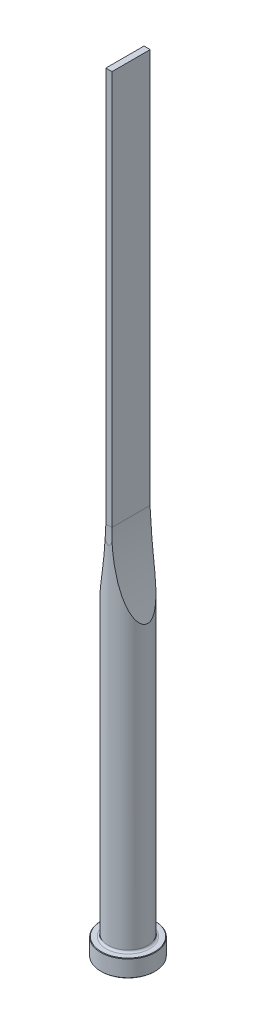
SolidWorks part; units mm, degrees
ref_plane "Front Plane" through (0, 0, 0) normal (0, 0, 1) x (1, 0, 0)
ref_plane "Top Plane" through (0, 0, 0) normal (0, 1, 0) x (1, 0, 0)
ref_plane "Right Plane" through (0, 0, 0) normal (1, 0, 0) x (0, 0, -1)
sketch "Sketch1" plane through (0, 0, 0) normal (0, 0, 1) x (1, 0, 0)
  line L0 (0, 0) -> (10.8, 0)
  line L1 (55, 0) -> (-55, 0) construction
  line L2 (11, 0.2) -> (11, 6.8)
  line L3 (10.8, 7) -> (8.8, 7)
  line L4 (8, 7.8) -> (8, 315)
  line L5 (0, 315) -> (8, 315)
  line L6 (11, 6.8) -> (10.8, 7)
  line L7 (10.8, 0) -> (11, 0.2)
  line L8 (0, 315) -> (0, 0)
  arc A0 (8, 7.8) -> (8.8, 7) centre (8.8, 7.8) ccw
  point P1 (11, 0)
  point P6 (11, 7)
  dimension "D4" = 0.8
  dimension "D1" = 8
  dimension "D2" = 11
  dimension "D3" = 7
  dimension "D5" = 315
revolve "Revolve1" add sketch "Sketch1" angle 360 about L8
sketch "Sketch2" plane through (0, 0, 0) normal (0, 0, 1) x (1, 0, 0)
  line L0 (1.25, 315) -> (1.25, 155)
  line L1 (8, 315) -> (-8, 315) construction
  line L2 (-1.25, 315) -> (-1.25, 155)
  line L3 (8, 315) -> (8, 120.803)
  line L4 (-8, 315) -> (-8, 120.803)
  line L5 (0, -12.1) -> (0, 12.1) construction
  line L6 (8, 315) -> (1.25, 315)
  line L8 (-1.25, 315) -> (-8, 315)
  arc A0 (1.25, 155) -> (8, 120.803) centre (91.25, 155) ccw
  arc A1 (-1.25, 155) -> (-8, 120.803) centre (-91.25, 155) cw
  dimension "D4" = 90
  dimension "D1" = 160
  dimension "D2" = 2.5
  dimension "D3" = 1.25
extrude "Cut-Extrude1" cut sketch "Sketch2" against normal mid plane 20
sketch "Sketch3" plane through (0, 0, 0) normal (1, 0, 0) x (0, 0, -1)
  line L0 (7.75, 315) -> (7.75, 155)
  line L1 (-7.9017, 315) -> (7.9017, 315) construction
  line L2 (-7.75, 315) -> (-7.75, 155)
  line L3 (8, 315) -> (8, 148.2965)
  line L4 (7.75, 315) -> (8, 315)
  line L5 (0, 12.1) -> (0, -12.1) construction
  line L6 (-8, 315) -> (-8, 148.2965)
  line L8 (-7.75, 315) -> (-8, 315)
  arc A0 (7.75, 155) -> (8, 148.2965) centre (97.75, 155) ccw
  arc A1 (-7.75, 155) -> (-8, 148.2965) centre (-97.75, 155) cw
  dimension "D2" = 90
  dimension "D1" = 160
  dimension "D3" = 15.5
  dimension "D4" = 7.75
extrude "Cut-Extrude2" cut sketch "Sketch3" against normal mid plane 20
